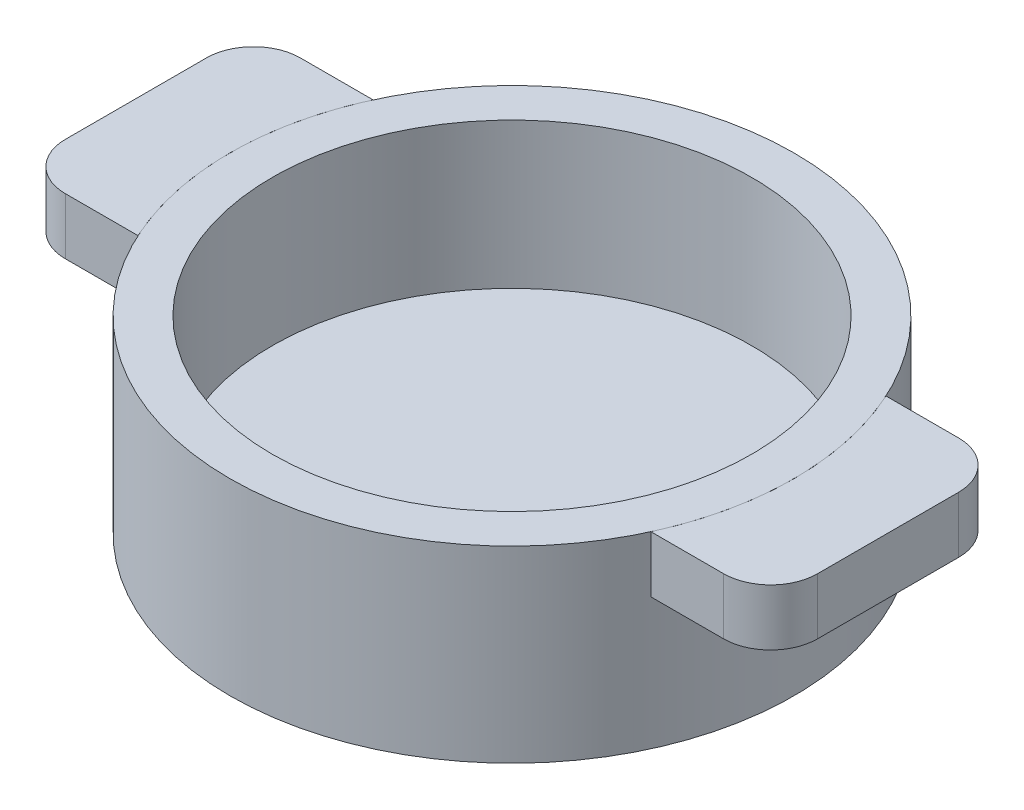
SolidWorks part; units mm, degrees
ref_plane "Front Plane" through (0, 0, 0) normal (0, 0, 1) x (1, 0, 0)
ref_plane "Top Plane" through (0, 0, 0) normal (0, 1, 0) x (1, 0, 0)
ref_plane "Right Plane" through (0, 0, 0) normal (1, 0, 0) x (0, 0, -1)
sketch "Sketch1" plane through (0, 0, 0) normal (0, 1, 0) x (1, 0, 0)
  circle A0 centre (0, 0) radius 60
extrude "Boss-Extrude1" add sketch "Sketch1" along normal blind 40
shell "Shell1" thickness 9
sketch "Sketch2" plane through (0, 40, 0) normal (0, 1, 0) x (1, 0, 0)
  line L0 (54.5436, 25) -> (70, 25)
  line L1 (-70, 25) -> (-54.5436, 25)
  line L2 (-80, 15) -> (-80, -15)
  line L3 (-70, -25) -> (-54.5436, -25)
  line L4 (80, 15) -> (80, -15)
  line L6 (-80, 0) -> (-60, 0) construction
  line L7 (60, 0) -> (80, 0) construction
  line L8 (54.5436, -25) -> (70, -25)
  arc A3 (70, -25) -> (80, -15) centre (70, -15) ccw
  arc A4 (80, 15) -> (70, 25) centre (70, 15) ccw
  arc A5 (-80, 15) -> (-70, 25) centre (-70, 15) cw
  arc A6 (-70, -25) -> (-80, -15) centre (-70, -15) cw
  circle A7 centre (0, 0) radius 60 construction
  arc A8 (-54.5436, 25) -> (-54.5436, -25) centre (0, 0) ccw
  arc A9 (54.5436, -25) -> (54.5436, 25) centre (0, 0) ccw
  point P0 (0, 0)
  point P10 (0, 0)
  dimension "D1" = 10
extrude "Boss-Extrude2" add sketch "Sketch2" against normal blind 12 separate body
